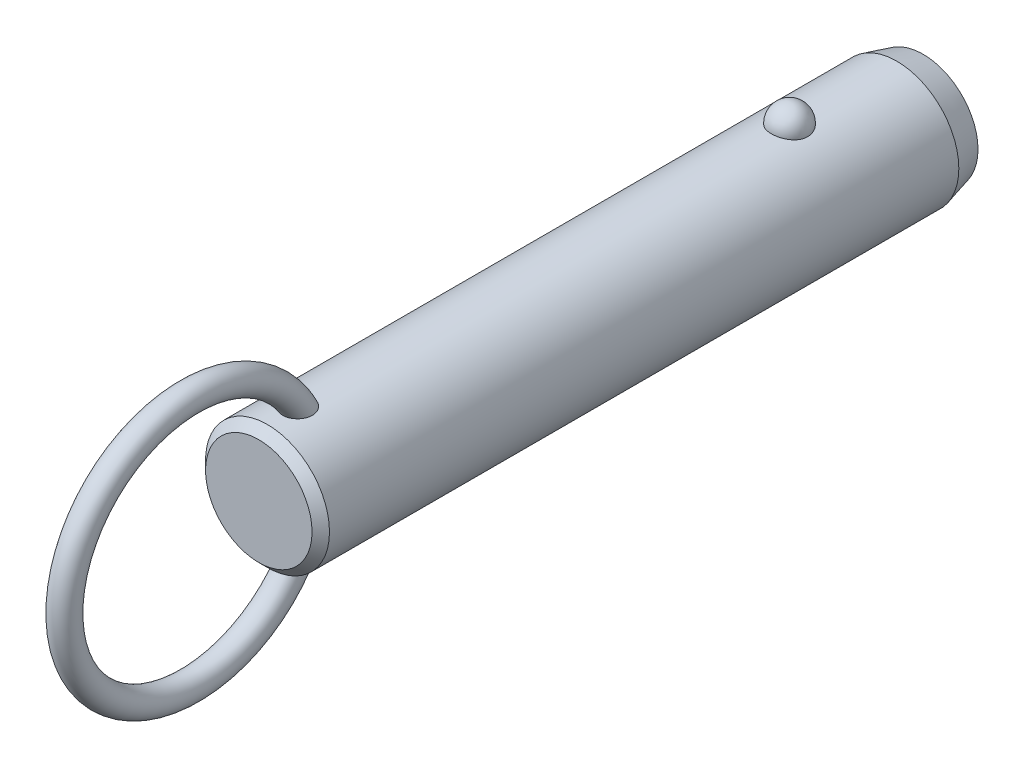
SolidWorks part; units mm, degrees
ref_plane "Front Plane" through (0, 0, 0) normal (0, 0, 1) x (1, 0, 0)
ref_plane "Top Plane" through (0, 0, 0) normal (0, 1, 0) x (1, 0, 0)
ref_plane "Right Plane" through (0, 0, 0) normal (1, 0, 0) x (0, 0, -1)
sketch "Sketch2" plane through (0, 0, 0) normal (0, 0, 1) x (1, 0, 0)
  circle A0 centre (0, 0) radius 7.1
  point P3 (0, 7.1)
  dimension "D1" = 14.2
extrude "Boss-Extrude1" add sketch "Sketch2" along normal blind 50.8
sketch "Sketch3" plane through (0, 0, 0) normal (0, 0, -1) x (-1, 0, 0)
  circle A0 centre (0, 0) radius 7.1
  dimension "D1" = 14.2
extrude "Boss-Extrude2" add sketch "Sketch3" along normal blind 17.4
chamfer "Chamfer1" distance 3 angle 15 1 edges at (-7.1, 0, -17.4)
sketch "Sketch12" plane through (0, 0, 0) normal (1, 0, 0) x (0, 0, -1)
  line L0 (-50.8, 7.1) -> (-50.8, -7.1) construction
  point P0 (-50.8, 0)
sketch "Sketch13" plane through (0, 0, 0) normal (1, 0, 0) x (0, 0, -1)
  circle A0 centre (-66.65, 0) radius 15.85
  point P2 (-50.8, 0)
  dimension "D1" = 31.7
sketch "Sketch14" plane through (0, 0, 0) normal (0, 1, 0) x (1, 0, 0)
  circle A0 centre (0, -52.3) radius 1.5
  point P2 (0, -50.8)
  dimension "D1" = 3
sweep "Sweep1" add profiles "Sketch14" path "Sketch13"
sketch "Sketch15" plane through (0, 0, 50.8) normal (0, 0, 1) x (1, 0, 0)
  circle A0 centre (0, 0) radius 7.1
  dimension "D1" = 14.2
extrude "Boss-Extrude3" add sketch "Sketch15" along normal blind 7.92
chamfer "Chamfer2" distance 1 angle 45 1 edges at (7.1, 0, 58.72)
sketch "Sketch18" plane through (0, 0, 0) normal (1, 0, 0) x (0, 0, -1)
  line L0 (14.4, 7.1) -> (-52.4792, 7.1) construction
  line L1 (2.1, 9.2) -> (2.1, 5)
  line L2 (-52.4792, -7.1) -> (14.4, -7.1) construction
  arc A0 (2.1, 9.2) -> (2.1, 5) centre (2.1, 7.1) ccw
  point P4 (0, 7.1)
  dimension "D1" = 16.3
revolve "Revolve1" add sketch "Sketch18" angle 360 about L1
